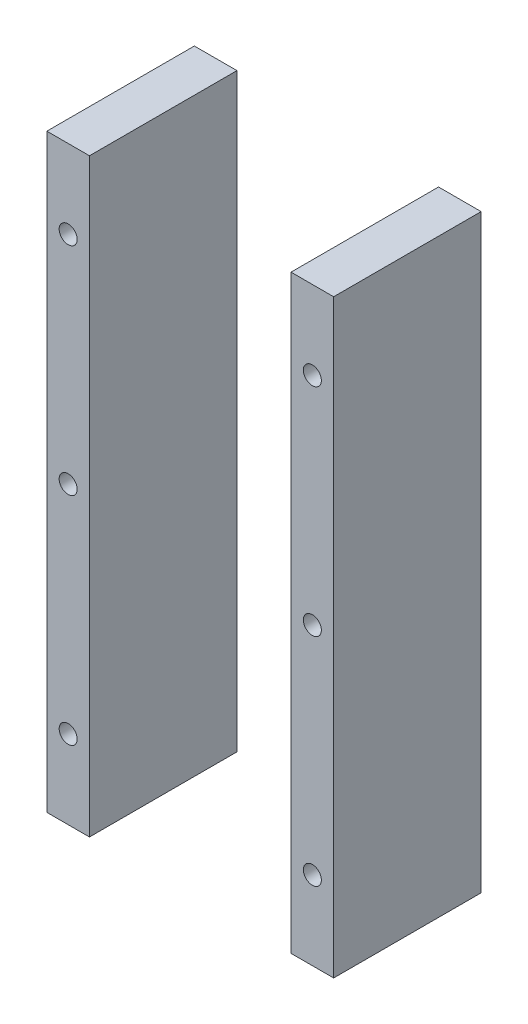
SolidWorks part; units mm, degrees
ref_plane "Alzado" through (0, 0, 0) normal (0, 0, 1) x (1, 0, 0)
ref_plane "Planta" through (0, 0, 0) normal (0, 1, 0) x (1, 0, 0)
ref_plane "Vista lateral" through (0, 0, 0) normal (1, 0, 0) x (0, 0, -1)
sketch "Croquis1" plane through (0, 0, 0) normal (0, 0, 1) x (1, 0, 0)
  line L0 (13, 180) -> (136, 180) construction
  line L1 (13, -180) -> (-13, -180)
  line L2 (13, -180) -> (13, 180)
  line L3 (13, 180) -> (-13, 180)
  line L4 (-13, -180) -> (-13, 180)
  line L5 (13, -180) -> (-13, 180) construction
  line L6 (13, 180) -> (-13, -180) construction
  line L7 (136, 180) -> (162, 180)
  line L8 (162, 180) -> (162, -180)
  line L9 (162, -180) -> (136, -180)
  line L10 (136, -180) -> (136, 180)
  point P0 (0, 0)
  dimension "D1" = 26
  dimension "D2" = 360
  dimension "D3" = 123
  dimension "D4" = 26
  dimension "D5" = 360
extrude "Saliente-Extruir1" add sketch "Croquis1" along normal blind 90
sketch "Croquis2" plane through (0, 0, 90) normal (0, 0, 1) x (1, 0, 0)
  line L0 (0, 180) -> (0, -180) construction
  line L1 (13, 180) -> (-13, 180) construction
  line L2 (-13, -180) -> (13, -180) construction
  line L3 (136, 180) -> (13, 180) construction
  line L4 (74.5, 180) -> (74.5, -180) construction
  line L5 (0, 180) -> (0, 132) construction
  line L6 (0, 0) -> (74.5, 0) construction
  circle A0 centre (0, 132) radius 5.5
  circle A1 centre (0, 0) radius 5.5
  circle A2 centre (0, -132) radius 5.5
  circle A3 centre (149, -132) radius 5.5
  circle A4 centre (149, 0) radius 5.5
  circle A5 centre (149, 132) radius 5.5
  dimension "D2" = 11
  dimension "D1" = 264
extrude "Cortar-Extruir1" cut sketch "Croquis2" against normal through all
